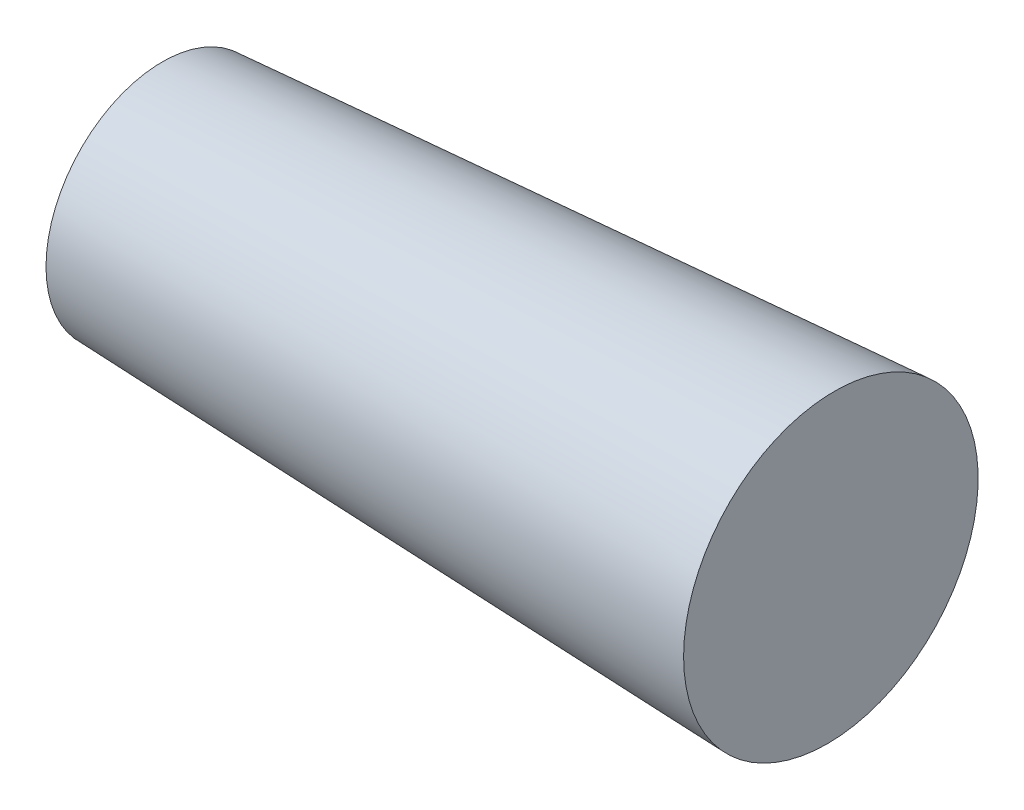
SolidWorks part; units mm, degrees
ref_plane "Plan1" through (0, 0, 0) normal (0, 0, 1) x (1, 0, 0)
ref_plane "Plan2" through (0, 0, 0) normal (0, 1, 0) x (1, 0, 0)
ref_plane "Plan3" through (0, 0, 0) normal (1, 0, 0) x (0, 0, -1)
sketch "Esquisse1" plane through (0, 0, 0) normal (0, 1, 0) x (1, 0, 0)
  line L1 (0, 0) -> (19, 0.4471) construction
  line L2 (0, 0) -> (19, 0.4471) construction
  line L4 (-17.1986, -5.232) -> (-17.4256, 4.4173) construction
  line L5 (-17.4256, 4.4173) -> (9.706, 6.4801) construction
  line L6 (10, -6.0164) -> (9.706, 6.4801) construction
  line L7 (-17.3121, -0.4073) -> (9.853, 0.2318)
  line L8 (-17.3121, -0.4073) -> (-17.4256, 4.4173)
  line L9 (-17.4256, 4.4173) -> (9.706, 6.4801)
  line L10 (9.853, 0.2318) -> (9.706, 6.4801)
revolve "Base-Révolution" add sketch "Esquisse1" angle 360 about L2
